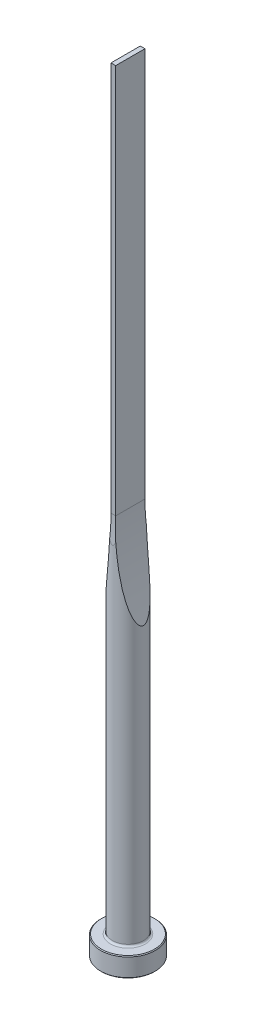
SolidWorks part; units mm, degrees
ref_plane "Front Plane" through (0, 0, 0) normal (0, 0, 1) x (1, 0, 0)
ref_plane "Top Plane" through (0, 0, 0) normal (0, 1, 0) x (1, 0, 0)
ref_plane "Right Plane" through (0, 0, 0) normal (1, 0, 0) x (0, 0, -1)
sketch "Sketch1" plane through (0, 0, 0) normal (0, 0, 1) x (1, 0, 0)
  line L0 (0, 0) -> (6.8, 0)
  line L1 (55, 0) -> (-55, 0) construction
  line L2 (7, 0.2) -> (7, 4.8)
  line L3 (6.8, 5) -> (4.5, 5)
  line L4 (4, 5.5) -> (4, 200)
  line L5 (0, 200) -> (4, 200)
  line L6 (7, 4.8) -> (6.8, 5)
  line L7 (6.8, 0) -> (7, 0.2)
  line L8 (0, 200) -> (0, 0)
  arc A0 (4, 5.5) -> (4.5, 5) centre (4.5, 5.5) ccw
  point P1 (7, 0)
  point P6 (7, 5)
  dimension "D4" = 0.5
  dimension "D1" = 4
  dimension "D2" = 7
  dimension "D3" = 5
  dimension "D5" = 200
revolve "Revolve1" add sketch "Sketch1" angle 360 about L8
sketch "Sketch2" plane through (0, 0, 0) normal (0, 0, 1) x (1, 0, 0)
  line L0 (0.6, 200) -> (0.6, 100)
  line L1 (4, 200) -> (-4, 200) construction
  line L2 (-0.6, 200) -> (-0.6, 100)
  line L3 (4, 200) -> (4, 75.4961)
  line L4 (-4, 200) -> (-4, 75.4961)
  line L5 (0, -7.7) -> (0, 7.7) construction
  line L6 (4, 200) -> (0.6, 200)
  line L8 (-0.6, 200) -> (-4, 200)
  arc A0 (0.6, 100) -> (4, 75.4961) centre (90.6, 100) ccw
  arc A1 (-0.6, 100) -> (-4, 75.4961) centre (-90.6, 100) cw
  dimension "D4" = 90
  dimension "D1" = 100
  dimension "D2" = 1.2
  dimension "D3" = 0.6
extrude "Cut-Extrude1" cut sketch "Sketch2" against normal mid plane 10
sketch "Sketch3" plane through (0, 0, 0) normal (1, 0, 0) x (0, 0, -1)
  line L0 (3.75, 200) -> (3.75, 100)
  line L1 (-3.9547, 200) -> (3.9547, 200) construction
  line L2 (-3.75, 200) -> (-3.75, 100)
  line L3 (4, 200) -> (4, 93.2965)
  line L4 (3.75, 200) -> (4, 200)
  line L5 (0, 7.7) -> (0, -7.7) construction
  line L6 (-4, 200) -> (-4, 93.2965)
  line L8 (-3.75, 200) -> (-4, 200)
  arc A0 (3.75, 100) -> (4, 93.2965) centre (93.75, 100) ccw
  arc A1 (-3.75, 100) -> (-4, 93.2965) centre (-93.75, 100) cw
  dimension "D2" = 90
  dimension "D1" = 100
  dimension "D3" = 7.5
  dimension "D4" = 3.75
extrude "Cut-Extrude2" cut sketch "Sketch3" against normal mid plane 10
